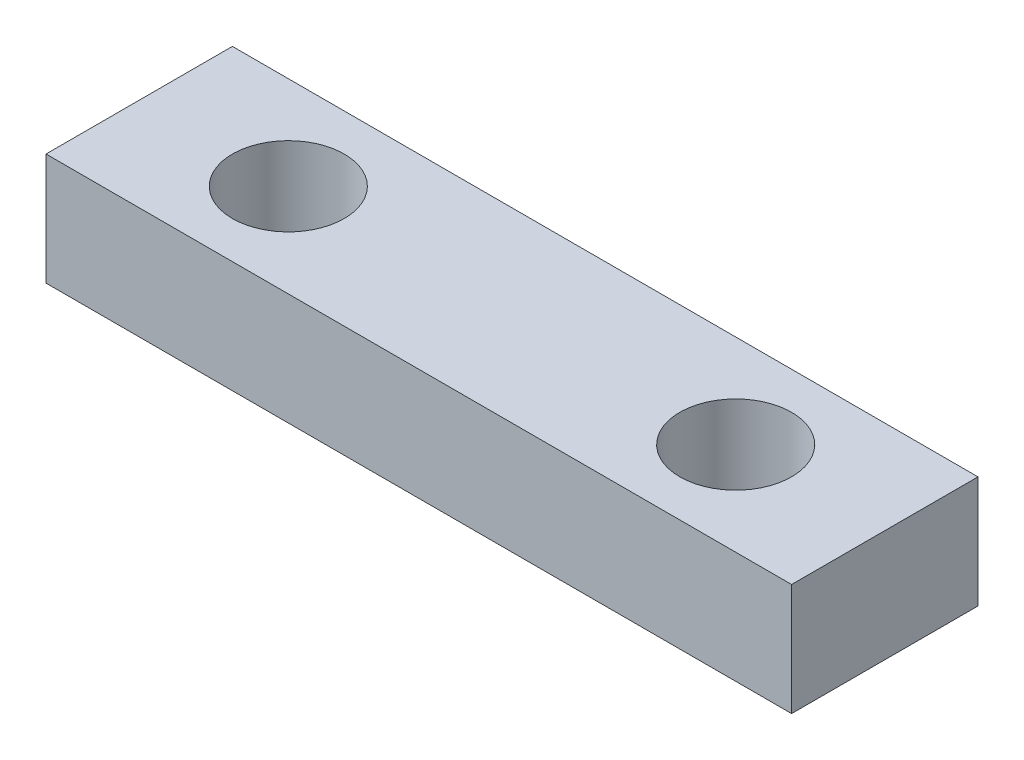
SolidWorks part; units mm, degrees
ref_plane "前视基准面" through (0, 0, 0) normal (0, 0, 1) x (1, 0, 0)
ref_plane "上视基准面" through (0, 0, 0) normal (0, 1, 0) x (1, 0, 0)
ref_plane "右视基准面" through (0, 0, 0) normal (1, 0, 0) x (0, 0, -1)
sketch "草图1" plane through (0, 0, 0) normal (0, 1, 0) x (1, 0, 0)
  line L1 (-10, 2.5) -> (10, 2.5)
  line L2 (-10, 2.5) -> (-10, -2.5)
  line L3 (-10, -2.5) -> (10, -2.5)
  line L4 (10, 2.5) -> (10, -2.5)
  line L5 (-10, 2.5) -> (10, -2.5) construction
  line L6 (-10, -2.5) -> (10, 2.5) construction
  point P0 (0, 0)
  dimension "D1" = 5
  dimension "D2" = 20
extrude "凸台-拉伸1" add sketch "草图1" along normal blind 3
sketch "草图2" plane through (0, 3, 0) normal (0, 1, 0) x (1, 0, 0)
  line L0 (10, 2.5) -> (-10, 2.5) construction
  circle A0 centre (-6, 0) radius 1.5
  circle A1 centre (6, 0) radius 1.5
  dimension "D1" = 3
  dimension "D2" = 3
  dimension "D3" = 12
  dimension "D4" = 6
  dimension "D5" = 2.5
  dimension "D6" = 2.5
extrude "切除-拉伸1" cut sketch "草图2" against normal blind 3
